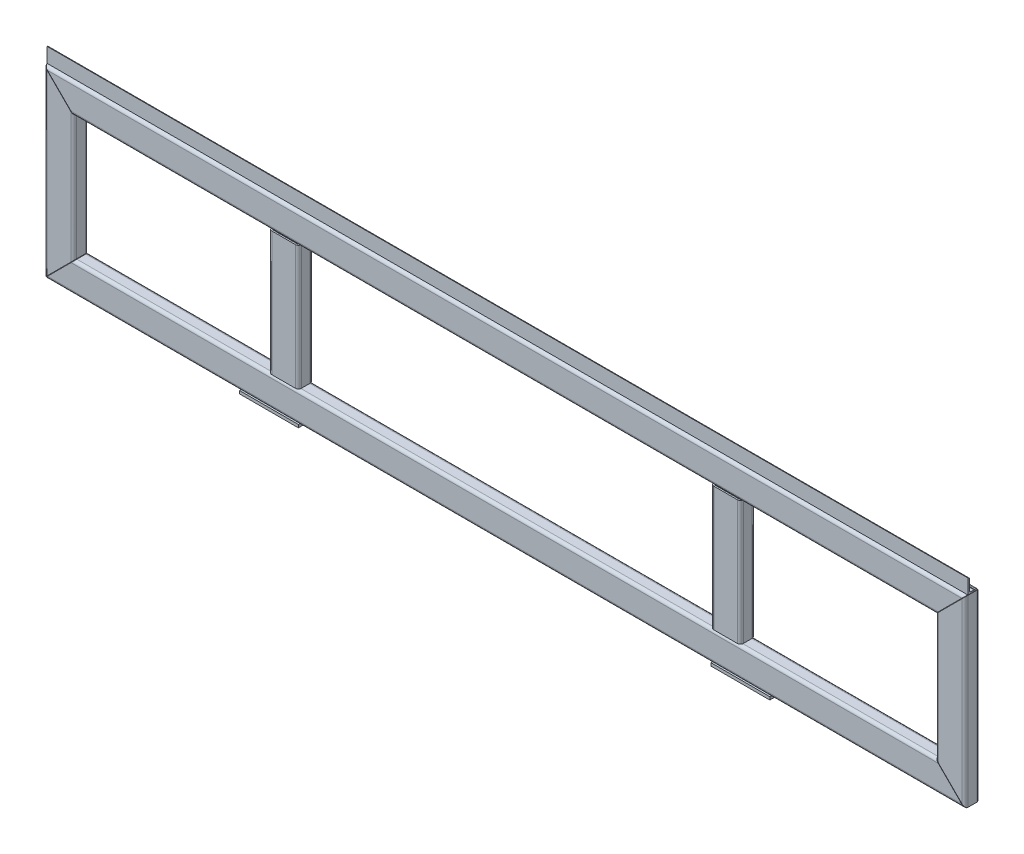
SolidWorks part; units mm, degrees
other "Detailelement1"
other "Detailelement2"
other "Detailelement6"
other "Detailelement7"
other "Detailelement9"
other "Detailelement10"
other "Detailelement13"
other "Detailelement14"
other "Detailelement15"
other "Detailelement12"
other "Detailelement16"
other "Detailelement17"
other "Schweißnaht-Ordner"
other "Schweißnaht1"
other "Schweißnaht2"
other "Schweißnaht6"
other "Schweißnaht7"
other "Schweißnaht9"
other "Schweißnaht10"
other "Schweißnaht12"
other "Schweißnaht13"
other "Schweißnaht16"
other "Schweißnaht17"
other "Schweißnaht14"
other "Schweißnaht15"
ref_plane "Front" through (0, 0, 0) normal (0, 0, 1) x (1, 0, 0)
ref_plane "Top" through (0, 0, 0) normal (0, 1, 0) x (1, 0, 0)
ref_plane "Right" through (0, 0, 0) normal (1, 0, 0) x (0, 0, -1)
sketch "Skizze1" plane through (0, 0, 0) normal (0, 0, 1) x (1, 0, 0)
  line L0 (610, 420) -> (610, 0)
  line L1 (0, 0) -> (2420, 0)
  line L2 (0, 0) -> (0, 420)
  line L3 (0, 420) -> (2420, 420)
  line L4 (2420, 0) -> (2420, 420)
  line L5 (1810, 420) -> (1810, 0)
  dimension "D1" = 420
  dimension "D2" = 2420
  dimension "D3" = 610
  dimension "D4" = 610
other "Strukturbauteil1"
ref_plane "Ebene1" through (0, 420, 0) normal (1, 0, 0) x (0, 0, 1)
sketch "Sketch16" plane through (0, 420, 0) normal (1, 0, 0) x (0, 0, 1)
  line L0 (-12, -36) -> (12, -36)
  line L1 (-16, -32) -> (-16, 32)
  line L2 (12, 36) -> (-12, 36)
  line L3 (16, 32) -> (16, -32)
  line L4 (-12, -40) -> (12, -40)
  line L5 (-20, -32) -> (-20, 32)
  line L6 (12, 40) -> (-12, 40)
  line L7 (20, 32) -> (20, -32)
  line L8 (-20, 0) -> (-16, 0) construction
  line L9 (-16, 0) -> (16, 0) construction
  line L10 (16, 0) -> (20, 0) construction
  line L11 (0, 40) -> (0, 36) construction
  line L12 (0, 36) -> (0, -36) construction
  line L13 (0, -36) -> (0, -40) construction
  arc A0 (20, 32) -> (12, 40) centre (12, 32) ccw
  arc A1 (12, -40) -> (20, -32) centre (12, -32) ccw
  arc A2 (-20, -32) -> (-12, -40) centre (-12, -32) ccw
  arc A3 (-12, 40) -> (-20, 32) centre (-12, 32) ccw
  arc A4 (-12, 36) -> (-16, 32) centre (-12, 32) ccw
  arc A5 (16, 32) -> (12, 36) centre (12, 32) ccw
  arc A6 (12, -36) -> (16, -32) centre (12, -32) ccw
  arc A7 (-16, -32) -> (-12, -36) centre (-12, -32) ccw
  point P6 (-20, 40)
  point P33 (-20, -40)
  point P34 (20, -40)
  point P36 (20, 40)
  point P37 (0, 0)
  dimension "D1" = 8
  dimension "Thickness" = 4
  dimension "V_leg" = 80
  dimension "H_leg" = 40
ref_plane "Ebene2" through (0, 0, 12) normal (0, 0, -1) x (-1, 0, 0)
sketch "Skizze9" plane through (0, 0, 12) normal (0, 0, -1) x (-1, 0, 0)
  line L4 (-2460.0089, 460) -> (40, 460)
other "Strukturbauteil2"
ref_plane "Ebene3"
sketch "Sketch1" plane through (2460.0089, 460, 12) normal (1, 0, 0) x (0, 0, -1)
  line L0 (0, 40) -> (0, 0)
  line L1 (4, 36) -> (0, 36) construction
  line L2 (4, 36) -> (4, 8)
  line L3 (8, 4) -> (16, 4)
  line L4 (16, 4) -> (16, 0) construction
  line L5 (20, 0) -> (0, 0)
  arc A0 (20, 0) -> (16, 4) centre (16, 0) ccw
  arc A1 (4, 36) -> (0, 40) centre (0, 36) ccw
  arc A2 (8, 4) -> (4, 8) centre (8, 8) cw
  point P2 (0, 20)
  point P9 (10, 0)
  point P10 (0, 0)
  dimension "Radius_2" = 4
  dimension "Radius_1" = 4
  dimension "V_leg" = 40
  dimension "H_leg" = 20
  dimension "thickness" = 4
sketch "Skizze10" plane through (0, -40, 0) normal (0, -1, 0) x (1, 0, 0)
  line L0 (-31.2929, 20) -> (2451.2929, 20) construction
  line L1 (490, 20) -> (650, 20)
  line L2 (490, 20) -> (490, -40.0583)
  line L3 (490, -40.0583) -> (650, -40.0583)
  line L4 (650, 20) -> (650, -40.0583)
  line L5 (2460, -12) -> (2460, 12) construction
  line L6 (1770, 20) -> (1930, 20)
  line L7 (1770, 20) -> (1770, -40.0583)
  line L8 (1770, -40.0583) -> (1930, -40.0583)
  line L9 (1930, 20) -> (1930, -40.0583)
  line L10 (-40, 12) -> (-40, -12) construction
  dimension "D1" = 160
  dimension "D2" = 160
  dimension "D3" = 530
  dimension "D4" = 530
extrude "Aufsatz-Linear austragen1" add sketch "Skizze10" along normal blind 8 separate body
